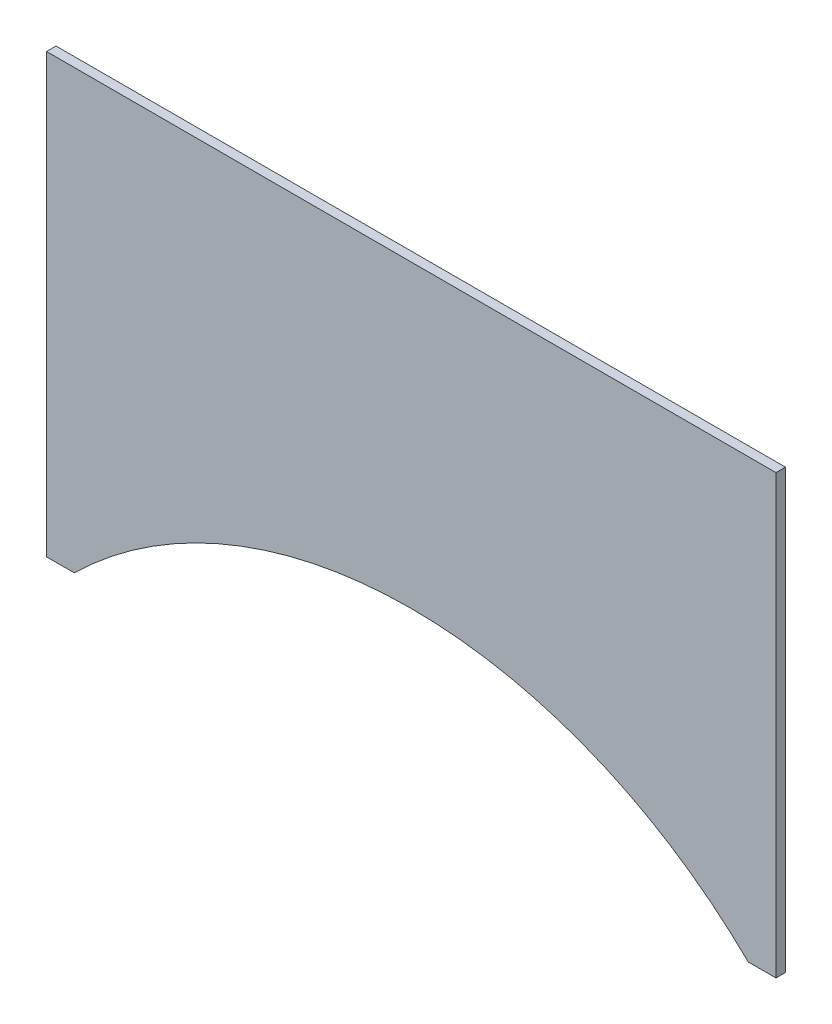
SolidWorks part; units mm, degrees
ref_plane "Front Plane" through (0, 0, 0) normal (0, 0, 1) x (1, 0, 0)
ref_plane "Top Plane" through (0, 0, 0) normal (0, 1, 0) x (1, 0, 0)
ref_plane "Right Plane" through (0, 0, 0) normal (1, 0, 0) x (0, 0, -1)
sketch "Sketch2" plane through (0, 0, 0) normal (0, 0, 1) x (1, 0, 0)
  line L0 (-484.2234, -431.6981) -> (-446.2234, -431.6981)
  line L1 (515.7766, -431.6981) -> (477.7766, -431.6981)
  line L2 (-484.2234, -431.6981) -> (-484.2234, 168.3019)
  line L3 (-484.2234, 168.3019) -> (515.7766, 168.3019)
  line L4 (515.7766, 168.3019) -> (515.7766, -431.6981)
  arc A0 (-446.2234, -431.6981) -> (477.7766, -431.6981) centre (15.7766, -903.0324) cw
extrude "Boss-Extrude2" add sketch "Sketch2" along normal blind 13
sketch "Sketch3" plane through (0, 0, 13) normal (0, 0, 1) x (1, 0, 0)
  text T0 "Kigali" font "Century Gothic" height in points 100
  point P1 (0, 0)
